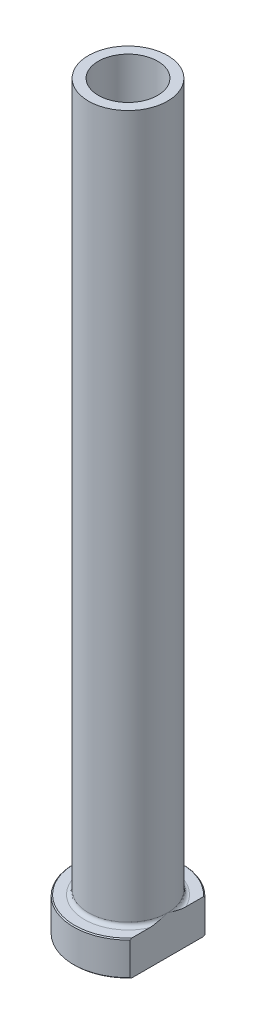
SolidWorks part; units mm, degrees
ref_plane "Front Plane" through (0, 0, 0) normal (0, 0, 1) x (1, 0, 0)
ref_plane "Top Plane" through (0, 0, 0) normal (0, 1, 0) x (1, 0, 0)
ref_plane "Right Plane" through (0, 0, 0) normal (1, 0, 0) x (0, 0, -1)
sketch "Sketch1" plane through (0, 0, 0) normal (0, 0, 1) x (1, 0, 0)
  line L0 (-6, 150) -> (-8, 150)
  line L1 (-8, 150) -> (-8, 7)
  line L2 (-8, 7) -> (-11, 7)
  line L3 (-11, 7) -> (-11, 0)
  line L4 (10.45, 0) -> (-10.45, 0) construction
  line L5 (-11, 0) -> (-6.25, 0)
  line L6 (-6, 95) -> (-6, 150)
  line L7 (0, 92.1877) -> (0, -15.5353) construction
  line L8 (0, -12.1) -> (0, 12.1) construction
  line L9 (-6, 95) -> (-6.25, 83)
  line L10 (-6.25, 83) -> (-6.25, 0)
  dimension "D1" = 0.25
  dimension "ID" = 12
  dimension "OD" = 16
  dimension "L" = 150
  dimension "H" = 22
  dimension "T" = 7
  dimension "N" = 55
  dimension "D2" = 12
  dimension "L-N" = 95
revolve "Revolve1" add sketch "Sketch1" angle 360 about L7
fillet "Fillet1" radius 0.8 1 edges at (0, 7, 8)
chamfer "Chamfer1" distance 0.2 angle 45 2 edges at (0, 7, 11) (0, 0, 11)
sketch "Sketch2" plane through (0, 0, 0) normal (0, -1, 0) x (1, 0, 0)
  line L0 (8, 7.5498) -> (8, -7.5498)
  circle A0 centre (0, 0) radius 11 construction
  arc A1 (8, 7.5498) -> (8, -7.5498) centre (0, 0) cw
  circle A2 centre (0, 0) radius 8 construction
extrude "Cut-Extrude1" cut sketch "Sketch2" against normal through all
chamfer "Chamfer2" distance 0.5 angle 45 1 edges at (0, 0, 6.25)
